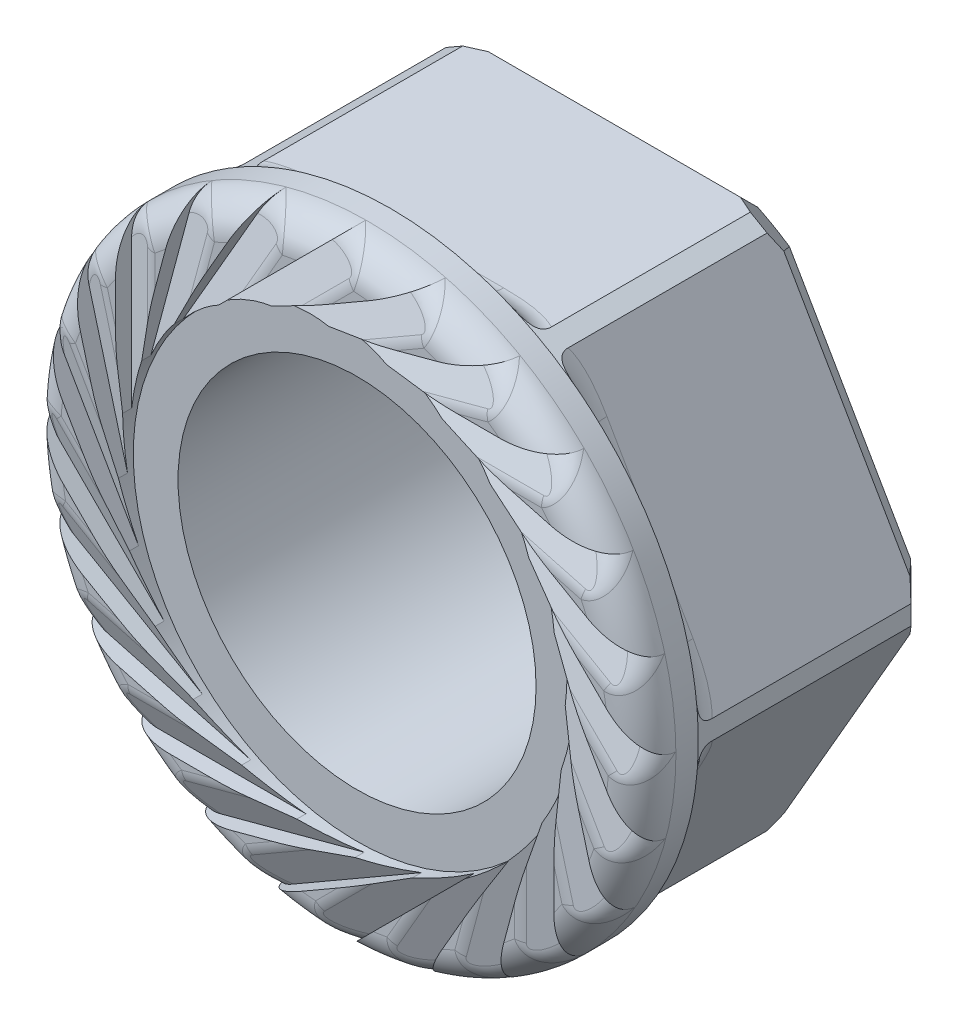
SolidWorks part; units mm, degrees
ref_plane "Спереди" through (0, 0, 0) normal (0, 0, 1) x (1, 0, 0)
ref_plane "Сверху" through (0, 0, 0) normal (0, 1, 0) x (1, 0, 0)
ref_plane "Справа" through (0, 0, 0) normal (1, 0, 0) x (0, 0, -1)
sketch "Эскиз1" plane through (0, 0, 0) normal (0, 0, 1) x (1, 0, 0)
  line L1 (-6.9282, -12) -> (6.9282, -12)
  line L2 (6.9282, -12) -> (13.8564, 0)
  line L3 (13.8564, 0) -> (6.9282, 12)
  line L4 (6.9282, 12) -> (-6.9282, 12)
  line L5 (-6.9282, 12) -> (-13.8564, 0)
  line L6 (-13.8564, 0) -> (-6.9282, -12)
  circle A0 centre (0, 0) radius 12 construction
  circle A1 centre (0, 0) radius 8
  dimension "D1" = 24
  dimension "D2" = 16
extrude "Бобышка-Вытянуть1" add sketch "Эскиз1" along normal blind 11
chamfer "Фаска1" distance 1 angle 45 6 edges at (0, -12, 0) (10.3923, -6, 0) (10.3923, 6, 0) (0, 12, 0) (-10.3923, 6, 0) (-10.3923, -6, 0)
sketch "Эскиз2" plane through (0, 0, 0) normal (0, 1, 0) x (1, 0, 0)
  line L0 (-11.3627, 0.8964) -> (-14.2591, -2)
  line L1 (-14.2591, -2) -> (-14.2591, -5.8)
  line L2 (-14.2591, -5.8) -> (-15.1995, -8.4704)
  line L3 (-15.1995, -8.4704) -> (-16.6988, -8.4704)
  line L4 (-16.6988, -8.4704) -> (-16.6988, 0.8964)
  line L5 (-16.6988, 0.8964) -> (-11.3627, 0.8964)
  line L7 (-12.7017, 0) -> (-6.3509, 0) construction
  line L8 (0, 2.1899) -> (0, -8.9342) construction
  dimension "D1" = 45
  dimension "D4" = 2
revolve "Вырез-Повернуть2" cut sketch "Эскиз2" angle 360 about L8
chamfer "Фаска2" distance 0.5 6 edges at (-6.9282, 12, 6.2986) (-13.8564, 0, 6.2986) (-6.9282, -12, 6.2986) (6.9282, -12, 6.2986) (13.8564, 0, 6.2986) (6.9282, 12, 6.2986)
sketch "Эскиз3" plane through (0, 0, 11) normal (0, 0, 1) x (1, 0, 0)
  circle A0 centre (0, 0) radius 8
  circle A1 centre (0, 0) radius 13.75
  dimension "D1" = 16
  dimension "D2" = 27.5
extrude "Бобышка-Вытянуть2" add sketch "Эскиз3" along normal blind 2.5
fillet "Скругление1" radius 1.2 6 edges at (10.3923, 6, 11) (10.3923, -6, 11) (0, -12, 11) (-10.3923, -6, 11) (-10.3923, 6, 11) (0, 12, 11)
sketch "Эскиз4" plane through (0, 0, 13.5) normal (0, 0, 1) x (1, 0, 0)
  circle A0 centre (0, 0) radius 10
  dimension "D1" = 20
extrude "Вырез-Вытянуть1" cut sketch "Эскиз4" against normal blind 1
fillet "Скругление2" radius 1.5 1 edges at (13.75, 0, 13.5)
sketch "Эскиз6" plane through (0, 0, 0) normal (0, 1, 0) x (1, 0, 0)
  line L0 (9.7957, -13.5) -> (9.7957, -12.777)
  line L1 (-10, -13.5) -> (10, -13.5) construction
  line L2 (9.7957, -12.777) -> (8.2628, -13.5)
  line L3 (8.2628, -13.5) -> (9.7957, -14.1261)
  line L4 (9.7957, -14.1261) -> (9.7957, -13.5)
extrude "Вырез-Вытянуть2" cut sketch "Эскиз6" against normal blind 17
fillet "Скругление3" radius 1 2 edges at (8.2628, -7.3381, 13.5) (8.5224, -9.6086, 13.3776)
pattern_circular "Круговой массив2" count 24 over 360 about axis through (0, 0, 11) along (0, 0, -1) of "Скругление3", "Вырез-Вытянуть2"
